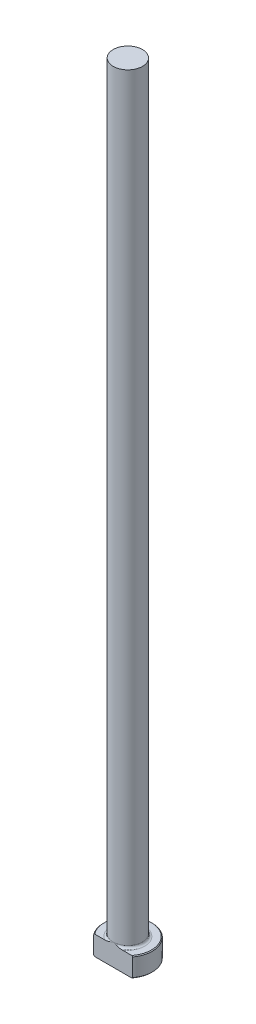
SolidWorks part; units mm, degrees
ref_plane "Front Plane" through (0, 0, 0) normal (0, 0, 1) x (1, 0, 0)
ref_plane "Top Plane" through (0, 0, 0) normal (0, 1, 0) x (1, 0, 0)
ref_plane "Right Plane" through (0, 0, 0) normal (1, 0, 0) x (0, 0, -1)
sketch "Sketch1" plane through (0, 0, 0) normal (0, 0, 1) x (1, 0, 0)
  line L0 (0, 259.9588) -> (0, -15.1925) construction
  line L1 (0, 0) -> (-7.9375, 0)
  line L2 (-7.9375, 0) -> (-7.9375, 6.35)
  line L3 (-7.9375, 6.35) -> (-4.7625, 6.35)
  line L4 (-4.7625, 6.35) -> (-4.7625, 254)
  line L5 (-4.7625, 254) -> (0, 254)
  line L6 (0, 254) -> (0, 0)
  dimension "L" = 254
  dimension "H" = 15.875
  dimension "T" = 6.35
  dimension "D" = 9.525
revolve "Revolve1" add sketch "Sketch1" angle 360 about L0
chamfer "Chamfer1" distance 0.254 angle 45 2 edges at (0, 6.35, 7.9375) (0, 0, 7.9375)
fillet "Fillet1" radius 0.762 1 edges at (0, 6.35, 4.7625)
sketch "Sketch2" plane through (0, 0, 0) normal (0, -1, 0) x (1, 0, 0)
  line L0 (-6.35, 4.7625) -> (6.35, 4.7625)
  arc A0 (6.35, 4.7625) -> (-6.35, 4.7625) centre (0, 0) ccw
  circle A1 centre (0, 0) radius 7.9375 construction
  circle A3 centre (0, 0) radius 4.7625 construction
extrude "KEY" cut sketch "Sketch2" against normal through all
sketch "Pocket Sketch" plane through (0, 0, 0) normal (0, 0, 1) x (1, 0, 0)
  line L0 (-8.3344, 0) -> (-8.3344, 6.3754)
  line L1 (-8.3344, 6.3754) -> (-5.9214, 6.3754)
  line L2 (-5.1594, 7.1374) -> (-5.1594, 22.225)
  line L3 (-5.1594, 22.225) -> (0, 22.225)
  line L4 (0, 22.225) -> (0, 0)
  line L5 (0, 0) -> (-8.3344, 0)
  line L6 (0, 12.6104) -> (0, -2.4989) construction
  line L7 (-7.9375, 6.096) -> (-7.9375, 0.254) construction
  line L8 (7.6835, 6.35) -> (-7.6835, 6.35) construction
  line L9 (-4.7625, 254) -> (-4.7625, 7.112) construction
  line L10 (-5.9214, 6.3754) -> (-5.1594, 7.1374)
  point P3 (-5.1594, 6.3754)
  dimension "D1" = 16.6687
  dimension "D2" = 0.3969
  dimension "D3" = 0.0254
  dimension "D4" = 0.3969
  dimension "D5" = 10.3187
  dimension "D6" = 22.225
